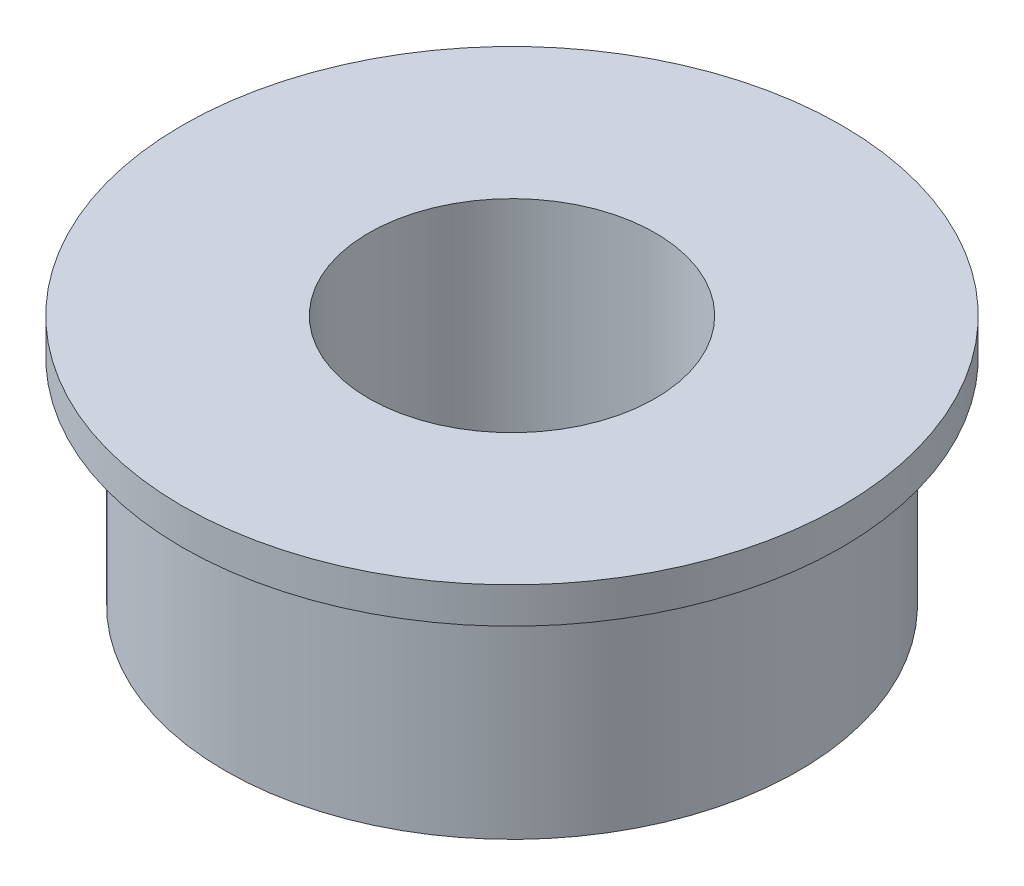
SolidWorks part; units mm, degrees
ref_plane "前视基准面" through (0, 0, 0) normal (0, 0, 1) x (1, 0, 0)
ref_plane "上视基准面" through (0, 0, 0) normal (0, 1, 0) x (1, 0, 0)
ref_plane "右视基准面" through (0, 0, 0) normal (1, 0, 0) x (0, 0, -1)
other "Configuration Table"
sketch "草图1" plane through (0, 0, 0) normal (0, 1, 0) x (1, 0, 0)
  circle A0 centre (0, 0) radius 4
  circle A1 centre (0, 0) radius 2
  dimension "D1" = 4
  dimension "D2" = 8
extrude "凸台-拉伸1" add sketch "草图1" along normal blind 3
sketch "草图2" plane through (0, 3, 0) normal (0, 1, 0) x (1, 0, 0)
  circle A0 centre (0, 0) radius 2
  circle A1 centre (0, 0) radius 4.6
  dimension "D1" = 9.2
  dimension "D2" = 4
extrude "凸台-拉伸2" add sketch "草图2" along normal blind 0.5
